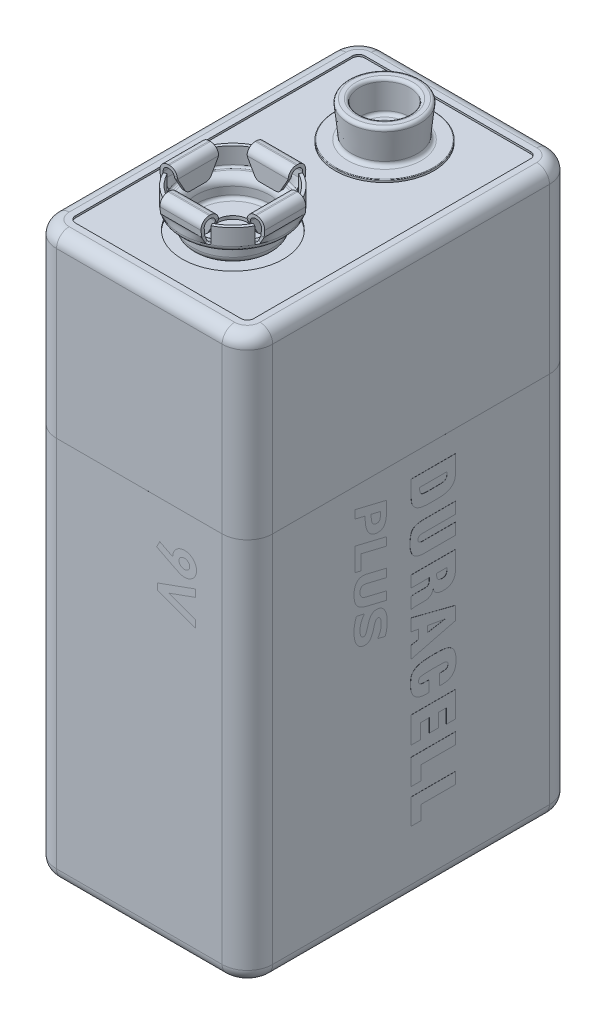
SolidWorks part; units mm, degrees
ref_plane "Front Plane" through (0, 0, 0) normal (0, 0, 1) x (1, 0, 0)
ref_plane "Top Plane" through (0, 0, 0) normal (0, 1, 0) x (1, 0, 0)
ref_plane "Right Plane" through (0, 0, 0) normal (1, 0, 0) x (0, 0, -1)
sketch "Sketch1" plane through (0, 0, 0) normal (0, 1, 0) x (1, 0, 0)
  line L1 (-15.1, 12.95) -> (-2, 12.95)
  line L2 (-17.1, 10.95) -> (-17.1, -10.95)
  line L3 (-15.1, -12.95) -> (-2, -12.95)
  line L4 (0, 10.95) -> (0, -10.95)
  arc A0 (-17.1, -10.95) -> (-15.1, -12.95) centre (-15.1, -10.95) ccw
  arc A1 (-2, -12.95) -> (0, -10.95) centre (-2, -10.95) ccw
  arc A2 (-2, 12.95) -> (0, 10.95) centre (-2, 10.95) cw
  arc A3 (-15.1, 12.95) -> (-17.1, 10.95) centre (-15.1, 10.95) ccw
  point P7 (-17.1, -12.95)
  point P12 (0, 12.95)
  point P15 (-17.1, 12.95)
  dimension "D3" = 2
  dimension "D1" = 17.1
  dimension "D2" = 25.9
extrude "Boss-Extrude1" add sketch "Sketch1" along normal blind 14
sketch "Sketch2" plane through (0, 14, 0) normal (0, 1, 0) x (-1, 0, 0)
  line L0 (0, 10.95) -> (0, -10.95) construction
  line L1 (15.1, -11.45) -> (2, -11.45)
  line L2 (15.6, -10.95) -> (15.6, 10.95)
  line L3 (15.1, 11.45) -> (2, 11.45)
  line L4 (1.5, -10.95) -> (1.5, 10.95)
  line L5 (17.1, -10.95) -> (17.1, 10.95) construction
  line L6 (2, -12.95) -> (15.1, -12.95) construction
  line L7 (15.1, 12.95) -> (2, 12.95) construction
  arc A0 (15.6, 10.95) -> (15.1, 11.45) centre (15.1, 10.95) ccw
  arc A1 (2, 11.45) -> (1.5, 10.95) centre (2, 10.95) ccw
  arc A2 (2, -11.45) -> (1.5, -10.95) centre (2, -10.95) cw
  arc A3 (15.1, -11.45) -> (15.6, -10.95) centre (15.1, -10.95) ccw
  point P10 (8.55, 12.95)
  dimension "D5" = 0.5
  dimension "D1" = 1.5
  dimension "D2" = 1.5
  dimension "D3" = 1.5
  dimension "D4" = 1.5
extrude "Cut-Extrude1" cut sketch "Sketch2" against normal blind 0.15
fillet "Fillet6" radius 1 8 edges at (-0.5858, 14, 12.3642) (-8.55, 14, 12.95) (-16.5142, 14, 12.3642) (-17.1, 14, 0) (-16.5142, 14, -12.3642) (-8.55, 14, -12.95) (-0.5858, 14, -12.3642) (0, 14, 0)
ref_plane "Plane2" through (0, -0.0001, 0) normal (0, -1, 0) x (1, 0, 0)
sketch "Sketch16" plane through (0, -0.0001, 0) normal (0, -1, 0) x (1, 0, 0)
  line L0 (-15.1, 12.95) -> (-2, 12.95)
  line L1 (-15.1, 12.95) -> (-2, 12.95) construction
  line L2 (-17.1, 10.95) -> (-17.1, -10.95)
  line L3 (-15.1, -12.95) -> (-2, -12.95)
  line L4 (0, 10.95) -> (0, -10.95)
  arc A0 (-15.1, 12.95) -> (-17.1, 10.95) centre (-15.1, 10.95) ccw construction
  arc A1 (-15.1, 12.95) -> (-17.1, 10.95) centre (-15.1, 10.95) ccw
  arc A2 (0, 10.95) -> (-2, 12.95) centre (-2, 10.95) ccw
  arc A3 (-17.1, -10.95) -> (-15.1, -12.95) centre (-15.1, -10.95) ccw
  arc A4 (-2, -12.95) -> (0, -10.95) centre (-2, -10.95) ccw
extrude "Boss-Extrude3" add sketch "Sketch16" along normal blind 30.5 separate body
ref_plane "Plane1" through (-8.55, 0, 0) normal (1, 0, 0) x (0, 0, -1)
sketch "Sketch4" plane through (-8.55, 0, 0) normal (1, 0, 0) x (0, 0, -1)
  line L0 (6.45, 49.3108) -> (6.45, 43.1213) construction
  line L1 (12.95, 13) -> (12.95, 0) construction
  line L2 (3.87, 16.85) -> (4.2, 16.85)
  line L4 (10.95, 13.85) -> (-10.95, 13.85) construction
  line L5 (4.45, 16.6) -> (4.45, 14.6)
  line L6 (4.7, 14.35) -> (5, 14.35)
  line L7 (5.25, 14.1) -> (5.25, 13.85)
  line L8 (5.25, 13.85) -> (2.55, 13.85)
  line L9 (2.55, 13.85) -> (2.55, 14)
  line L10 (2.6, 14.05) -> (3.55, 14.05)
  line L11 (3.8484, 14.3809) -> (3.6213, 16.5743)
  arc A0 (3.55, 14.05) -> (3.8484, 14.3809) centre (3.55, 14.35) ccw
  arc A1 (3.87, 16.85) -> (3.6213, 16.5743) centre (3.87, 16.6) ccw
  arc A2 (5, 14.35) -> (5.25, 14.1) centre (5, 14.1) cw
  arc A3 (4.45, 14.6) -> (4.7, 14.35) centre (4.7, 14.6) ccw
  arc A4 (4.45, 16.6) -> (4.2, 16.85) centre (4.2, 16.6) ccw
  arc A5 (2.55, 14) -> (2.6, 14.05) centre (2.6, 14) cw
  point P19 (3.5928, 16.85)
  point P23 (4.45, 14.35)
  point P26 (4.45, 16.85)
  point P29 (2.55, 14.05)
  dimension "D9" = 0.3
  dimension "D10" = 0.25
  dimension "D12" = 0.25
  dimension "D13" = 0.25
  dimension "D14" = 0.05
  dimension "D1" = 6.5
  dimension "D2" = 3
  dimension "D3" = 2.58
  dimension "D4" = 3.9
  dimension "D5" = 0.2
  dimension "D6" = 2
  dimension "D7" = 2.5
  dimension "D8" = 1.2
  dimension "D11" = 2.9
revolve "Revolve1" add sketch "Sketch4" angle 360 about L0
sketch "Sketch5" plane through (-8.55, 0, 0) normal (1, 0, 0) x (0, 0, -1)
  line L0 (-5.55, 48.6561) -> (-5.55, 41.4975) construction
  line L1 (6.45, 13.2782) -> (6.45, 15.7435) construction
  line L2 (10.95, 13.85) -> (-10.95, 13.85) construction
  line L3 (-5.55, 13.85) -> (-9.55, 13.85)
  line L4 (-5.55, 13.85) -> (-5.55, 13.7)
  line L5 (-5.55, 13.7) -> (-9.55, 13.7)
  line L6 (-9.55, 13.85) -> (-9.55, 13.7)
  dimension "D1" = 12
  dimension "D2" = 0.15
  dimension "D3" = 0.15
  dimension "D4" = 4
revolve "Cut-Revolve1" cut sketch "Sketch5" angle 360 about L0
sketch "Sketch6" plane through (-8.55, 0, 0) normal (1, 0, 0) x (0, 0, -1)
  line L0 (-5.55, 48.7474) -> (-5.55, 43.448) construction
  line L1 (6.45, 13.2782) -> (6.45, 15.7435) construction
  line L2 (-8.7, 14.8) -> (-8.7, 14.2)
  line L3 (-1.55, 13.7) -> (-9.55, 13.7) construction
  line L4 (-8.2, 13.7) -> (-6.8, 13.7)
  line L5 (-6.8, 13.7) -> (-6.8, 13.95)
  line L6 (-6.8, 13.95) -> (-8.2, 13.95)
  line L8 (-9.65, 16.9) -> (-9.65, 15.6)
  line L9 (-9.65, 16.9) -> (-9.4, 16.9)
  line L10 (-9.4, 16.9) -> (-9.4, 15.6)
  line L11 (-9.1, 15.2) -> (-9.25, 15.2)
  line L12 (-8.2, 13.95) -> (-6.8, 13.95)
  line L13 (-8.45, 14.8) -> (-8.45, 14.2)
  line L14 (-9.25, 15.45) -> (-9.1, 15.45)
  line L15 (-8.2, 13.7) -> (-5.55, 13.7) construction
  line L18 (-8.2, 13.95) -> (-5.55, 13.95) construction
  line L19 (-9.4, 16.9) -> (-9.4, 15.5248) construction
  line L20 (-9.1, 15.45) -> (-9.1615, 15.45) construction
  line L21 (-9.1615, 15.45) -> (-9.1615, 15.45) construction
  line L22 (-9.1615, 15.45) -> (-9.1615, 15.45) construction
  line L23 (-9.1615, 15.45) -> (-9.1615, 15.45) construction
  arc A0 (-8.7, 14.2) -> (-8.2, 13.7) centre (-8.2, 14.2) ccw
  arc A1 (-8.7, 14.8) -> (-9.1, 15.2) centre (-9.1, 14.8) ccw
  arc A2 (-9.25, 15.2) -> (-9.65, 15.6) centre (-9.25, 15.6) cw
  arc A3 (-8.45, 14.2) -> (-8.2, 13.95) centre (-8.2, 14.2) ccw
  arc A4 (-8.45, 14.8) -> (-9.1, 15.45) centre (-9.1, 14.8) ccw
  arc A6 (-9.4, 15.6) -> (-9.25, 15.45) centre (-9.25, 15.6) ccw
  arc A7 (-9.1615, 15.45) -> (-9.1615, 15.45) centre (-9.1615, 15.45) cw construction
  point P15 (-8.7, 13.7)
  point P22 (-8.7, 15.2)
  dimension "D2" = 0.5
  dimension "D9" = 0.4
  dimension "D10" = 0.4
  dimension "D12" = 0.15
  dimension "D1" = 12
  dimension "D3" = 3.15
  dimension "D4" = 1.25
  dimension "D5" = 4.1
  dimension "D6" = 3.2
  dimension "D7" = 0.25
  dimension "D8" = 1
  dimension "D13" = 0.25
revolve "Revolve2" add sketch "Sketch6" angle 360 about L0
sketch "Sketch7" plane through (0, 16.9, 0) normal (0, 1, 0) x (1, 0, 0)
  line L0 (-10.2183, -2.3599) -> (-10.45, -1.9168)
  line L1 (-8.55, -1.7) -> (-8.55, -1.45)
  line L2 (-8.55, -20.1056) -> (-8.55, 20.1056) construction
  line L3 (-8.55, -1.45) -> (-8.55, -5.55) construction
  line L4 (-6.8817, -2.3599) -> (-6.65, -1.9168)
  circle A0 centre (-8.55, -5.55) radius 4.1 construction
  arc A1 (-6.65, -1.9168) -> (-10.45, -1.9168) centre (-8.55, -5.55) ccw
  arc A2 (-6.8817, -2.3599) -> (-10.2183, -2.3599) centre (-8.55, -5.55) ccw
  dimension "D1" = 1.9
  dimension "D2" = 0.5
  dimension "D3" = 27.608
extrude "Cut-Extrude4" cut sketch "Sketch7" against normal blind 1.3 contours L3 L0 A2 M1 | L3 A2 L4 M1 | L4 L1 M1 M2 | L1 L0 M1 M2
sketch "Sketch19" plane through (0, -30.5001, 0) normal (0, -1, 0) x (1, 0, 0)
  line L0 (-15.1, -12.95) -> (-2, -12.95) construction
  line L1 (-14.6, 10.95) -> (-2.5, 10.95)
  line L2 (-15.1, 10.45) -> (-15.1, -10.45)
  line L3 (-14.6, -10.95) -> (-2.5, -10.95)
  line L4 (-2, 10.45) -> (-2, -10.45)
  line L5 (0, -10.95) -> (0, 10.95) construction
  line L6 (-2, 12.95) -> (-15.1, 12.95) construction
  line L7 (-17.1, 10.95) -> (-17.1, -10.95) construction
  arc A0 (-15.1, -10.45) -> (-14.6, -10.95) centre (-14.6, -10.45) ccw
  arc A1 (-2.5, -10.95) -> (-2, -10.45) centre (-2.5, -10.45) ccw
  arc A2 (-2.5, 10.95) -> (-2, 10.45) centre (-2.5, 10.45) cw
  arc A3 (-14.6, 10.95) -> (-15.1, 10.45) centre (-14.6, 10.45) ccw
  dimension "D5" = 0.5
  dimension "D1" = 2
  dimension "D2" = 2
  dimension "D3" = 2
  dimension "D4" = 2
extrude "Cut-Extrude6" cut sketch "Sketch19" against normal blind 0.15
fillet "Fillet3" radius 0.1 2 edges at (-6.7079, 15.6, 2.0276) (-10.3921, 15.6, 2.0276)
pattern_circular "CirPattern4" count 4 over 360 about axis through (-8.55, 0, 5.55) along (0, 1, 0) of "Cut-Extrude4", "Fillet3"
sketch "Sketch9" plane through (-8.55, 0, 0) normal (1, 0, 0) x (0, 0, -1)
  line L0 (-8.3, 15.45) -> (-8.3, 16.75)
  line L1 (-8.95, 17.4) -> (-9.0436, 17.4)
  line L2 (-5.55, 15.6) -> (-5.55, 16.9) construction
  line L3 (-5.55, 13.4219) -> (-5.55, 19.9562) construction
  line L4 (-7.3341, 16.9) -> (-8.9616, 16.9) construction
  line L5 (-1.85, 15.45) -> (-9.25, 15.45) construction
  line L6 (-8.3, 15.45) -> (-8.55, 15.45)
  line L7 (-8.55, 15.45) -> (-8.55, 16.75)
  line L8 (-8.95, 17.15) -> (-9.0436, 17.15)
  line L9 (-9.6913, 16.696) -> (-9.65, 16.2)
  line L10 (-9.2284, 15.6) -> (-9.65, 15.6) construction
  line L11 (-9.3991, 16.2) -> (-9.4422, 16.7168)
  line L12 (-9.65, 16.2) -> (-9.3991, 16.2)
  arc A0 (-8.55, 16.75) -> (-8.95, 17.15) centre (-8.95, 16.75) ccw
  arc A1 (-9.4422, 16.7168) -> (-9.0436, 17.15) centre (-9.0436, 16.75) cw
  arc A2 (-8.3, 16.75) -> (-8.95, 17.4) centre (-8.95, 16.75) ccw
  arc A3 (-9.6913, 16.696) -> (-9.0436, 17.4) centre (-9.0436, 16.75) cw
  point P26 (-9.75, 17.4)
  dimension "D9" = 0.4
  dimension "D10" = 0.65
  dimension "D1" = 2.75
  dimension "D2" = 0.5
  dimension "D3" = 4.2
  dimension "D4" = 0.25
  dimension "D5" = 0.25
  dimension "D6" = 0.6
  dimension "D7" = 4.1
  dimension "D8" = 0.25
extrude "Boss-Extrude2" add sketch "Sketch9" along normal mid plane 3.25 separate body
sketch "Sketch10" plane through (0, 15.6, 0) normal (0, 1, 0) x (1, 0, 0)
  line L0 (-10.0759, -9.0847) -> (-10.175, -9.3142)
  line L1 (-7.0241, -9.0847) -> (-6.925, -9.3142)
  line L2 (-8.55, -5.55) -> (-8.55, -9.65) construction
  arc A0 (-10.3608, -9.2284) -> (-6.7392, -9.2284) centre (-8.55, -5.55) ccw construction
  arc A1 (-10.175, -9.3142) -> (-6.925, -9.3142) centre (-8.55, -5.55) ccw
  arc A2 (-10.0759, -9.0847) -> (-7.0241, -9.0847) centre (-8.55, -5.55) ccw
  circle A3 centre (-8.55, -5.55) radius 3.55 construction
  dimension "D3" = 0.3
  dimension "D1" = 3.25
  dimension "D2" = 1.625
  dimension "D4" = 1.5259
  dimension "D5" = 3.0518
sketch "Sketch11" plane through (0, 16.2, 0) normal (0, -1, 0) x (1, 0, 0)
  line L1 (-10.175, 9.65) -> (-6.925, 9.65)
  line L2 (-10.175, 9.65) -> (-10.175, 9.3991)
  line L3 (-10.175, 9.3991) -> (-6.925, 9.3991)
  line L4 (-6.925, 9.65) -> (-6.925, 9.3991)
loft "Loft1" add profiles "Sketch11", "Sketch10"
fillet "Fillet4" radius 0.1 2 edges
sketch "Sketch12" plane through (0, 0, 8.3) normal (0, 0, -1) x (-1, 0, 0)
  line L0 (6.925, 16.75) -> (7.65, 15.45)
  line L1 (6.925, 15.45) -> (10.175, 15.45) construction
  line L2 (7.65, 15.45) -> (6.925, 15.45)
  line L3 (6.925, 15.45) -> (6.925, 16.75)
  line L4 (10.175, 16.75) -> (9.45, 15.45)
  line L5 (9.45, 15.45) -> (10.175, 15.45)
  line L6 (10.175, 15.45) -> (10.175, 16.75) construction
  line L7 (10.175, 15.45) -> (10.175, 16.75)
  dimension "D1" = 1.8
  dimension "D2" = 0.725
extrude "Cut-Extrude5" cut sketch "Sketch12" against normal blind 0.25
fillet "Fillet5" radius 0.5 4 edges at (-6.925, 16.75, 8.425) (-10.175, 16.75, 8.425) (-9.45, 15.45, 8.425) (-7.65, 15.45, 8.425)
pattern_circular "CirPattern6" count 4 over 360 about axis through (-8.55, 48.7474, 5.55) along (0, 1, 0) of "Fillet5", "Cut-Extrude5", "Fillet4", "Loft1", "Boss-Extrude2"
fillet "Fillet7" radius 1 8 edges at (-0.5858, -30.5001, -12.3642) (-8.55, -30.5001, -12.95) (-16.5142, -30.5001, -12.3642) (-17.1, -30.5001, 0) (-16.5142, -30.5001, 12.3642) (-8.55, -30.5001, 12.95) (-0.5858, -30.5001, 12.3642) (0, -30.5001, 0)
sketch "Sketch13" plane through (0, 0, 0) normal (1, 0, 0) x (0, 0, -1)
  line L0 (0, -1.5001) -> (0, -26.5001) construction
  line L3 (10.95, -30.5001) -> (-10.95, -30.5001) construction
  text T0 "DURACELL" font "@Adobe Heiti Std R" height 3.5
  dimension "D1" = 4
  dimension "D2" = 25
  dimension "D3" = 0
wrap "Wrap1" sketch "Sketch13" wrap type emboss source sketch "Sketch13" thickness 0.01 parameters "D1"=0.01
sketch "Sketch14" plane through (0, 0, 0) normal (1, 0, 0) x (0, 0, -1)
  line L0 (-4.45, -1.5001) -> (-4.45, -10.5001) construction
  line L1 (-12.95, 13) -> (-12.95, 0) construction
  line L2 (10.95, -30.5001) -> (-10.95, -30.5001) construction
  text T0 "<b>PLUS</b>" font "Verdana" height 2.5
  dimension "D1" = 9
  dimension "D2" = 20
  dimension "D3" = 8.5
wrap "Wrap2" sketch "Sketch14" wrap type scribe source sketch "Sketch14"
sketch "Sketch17" plane through (0, 0, 12.95) normal (0, 0, 1) x (1, 0, 0)
  line L0 (-7.1, -2.0001) -> (-7.1, -8.0001) construction
  line L1 (-15.1, -29.5001) -> (-15.1, -0.0001) construction
  line L2 (-2, -0.0001) -> (-15.1, -0.0001) construction
  text T0 "<b>9V</b>" font "Century Gothic" height 3
  dimension "D1" = 8
  dimension "D2" = 6
  dimension "D3" = 2
wrap "Wrap3" sketch "Sketch17" wrap type scribe source sketch "Sketch17"
sketch "Sketch18" plane through (0, 0, -12.95) normal (0, 0, -1) x (-1, 0, 0)
  line L0 (9, 3.5) -> (9, 2)
  line L1 (8, 6) -> (9, 6)
  line L2 (8, 6) -> (8, 4.5)
  line L3 (8, 2) -> (9, 2)
  line L4 (9, 6) -> (9, 4.5)
  line L5 (6.5, 4.5) -> (8, 4.5)
  line L6 (6.5, 4.5) -> (6.5, 3.5)
  line L7 (6.5, 3.5) -> (8, 3.5)
  line L8 (10.5, 4.5) -> (10.5, 3.5)
  line L9 (8, 3.5) -> (8, 2)
  line L10 (9, 4.5) -> (10.5, 4.5)
  line L11 (9, 3.5) -> (10.5, 3.5)
  line L12 (2, 0) -> (15.1, 0) construction
  line L13 (2, -29.5001) -> (2, -0.0001) construction
  dimension "D1" = 4
  dimension "D2" = 4
  dimension "D3" = 1
  dimension "D4" = 1
  dimension "D5" = 1.5
  dimension "D6" = 1.5
  dimension "D7" = 2
  dimension "D8" = 6
wrap "Wrap4" sketch "Sketch18" wrap type scribe source sketch "Sketch18"
